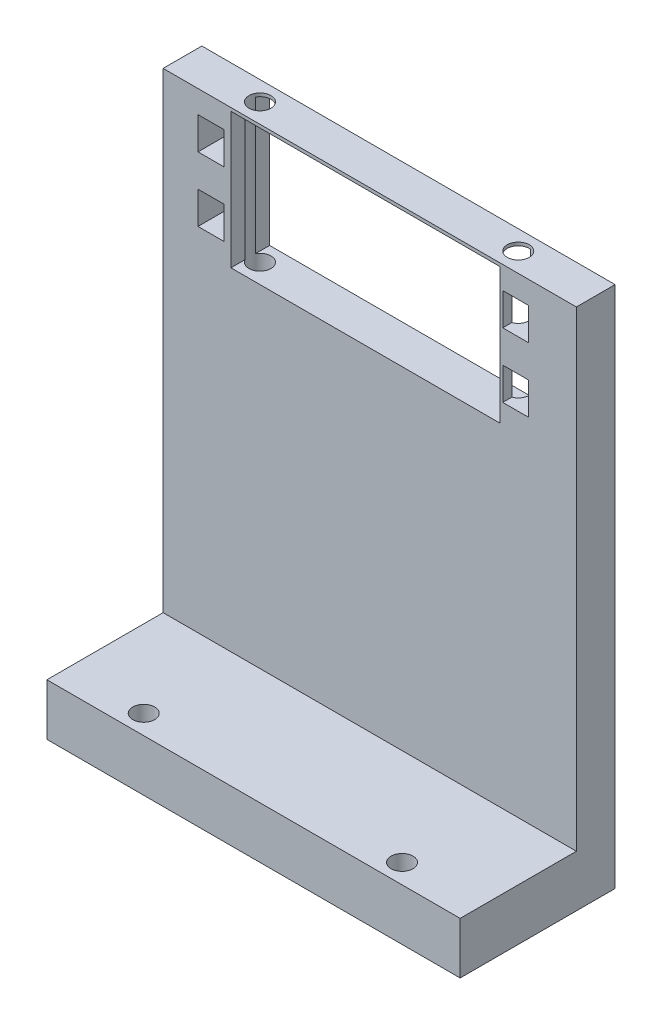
SolidWorks part; units mm, degrees
ref_plane "前视基准面" through (0, 0, 0) normal (0, 0, 1) x (1, 0, 0)
ref_plane "上视基准面" through (0, 0, 0) normal (0, 1, 0) x (1, 0, 0)
ref_plane "右视基准面" through (0, 0, 0) normal (1, 0, 0) x (0, 0, -1)
other "Configuration Table"
sketch "草图1" plane through (0, 0, 0) normal (0, 0, 1) x (1, 0, 0)
  line L1 (-21, 0) -> (43, 0)
  line L2 (-21, 0) -> (-21, 8)
  line L3 (-21, 8) -> (43, 8)
  line L4 (43, 0) -> (43, 8)
extrude "Servo_foot" add sketch "草图1" along normal blind 24
sketch "草图2" plane through (0, 0, 0) normal (0, 0, 1) x (1, 0, 0)
  line L1 (-21, 0) -> (43, 0)
  line L2 (-21, 0) -> (-21, 81)
  line L3 (-21, 81) -> (43, 81)
  line L4 (43, 0) -> (43, 81)
extrude "Servo_face_plate" add sketch "草图2" along normal blind 6
sketch "草图3" plane through (0, 0, 0) normal (0, 0, 1) x (1, 0, 0)
  line L1 (-10.5, 59.5) -> (31.2, 59.5)
  line L2 (-10.5, 59.5) -> (-10.5, 80.5)
  line L3 (-10.5, 80.5) -> (31.2, 80.5)
  line L4 (31.2, 59.5) -> (31.2, 80.5)
extrude "MG995_body_window_REFERENCE" cut sketch "草图3" against normal through all and the other way through all
sketch "草图4" plane through (0, 0, 0) normal (0, 0, 1) x (1, 0, 0)
  line L1 (-15.6, 62.5) -> (-11.6, 62.5)
  line L2 (-15.6, 62.5) -> (-15.6, 67.5)
  line L3 (-15.6, 67.5) -> (-11.6, 67.5)
  line L4 (-11.6, 62.5) -> (-11.6, 67.5)
  line L6 (-15.6, 72.5) -> (-11.6, 72.5)
  line L7 (-15.6, 72.5) -> (-15.6, 77.5)
  line L8 (-15.6, 77.5) -> (-11.6, 77.5)
  line L9 (-11.6, 72.5) -> (-11.6, 77.5)
  line L11 (31.6, 62.5) -> (35.6, 62.5)
  line L12 (31.6, 62.5) -> (31.6, 67.5)
  line L13 (31.6, 67.5) -> (35.6, 67.5)
  line L14 (35.6, 62.5) -> (35.6, 67.5)
  line L16 (31.6, 72.5) -> (35.6, 72.5)
  line L17 (31.6, 72.5) -> (31.6, 77.5)
  line L18 (31.6, 77.5) -> (35.6, 77.5)
  line L19 (35.6, 72.5) -> (35.6, 77.5)
extrude "MG995_47p2x10_reference_slots_VERIFY" cut sketch "草图4" against normal through all and the other way through all
sketch "草图5" plane through (0, 0, 0) normal (0, 1, 0) x (1, 0, 0)
  circle A0 centre (-9, -3) radius 1.7
  circle A1 centre (-9, -21) radius 1.7
  circle A2 centre (31, -3) radius 1.7
  circle A3 centre (31, -21) radius 1.7
extrude "Servo_foot_M3" cut sketch "草图5" against normal through all and the other way through all
